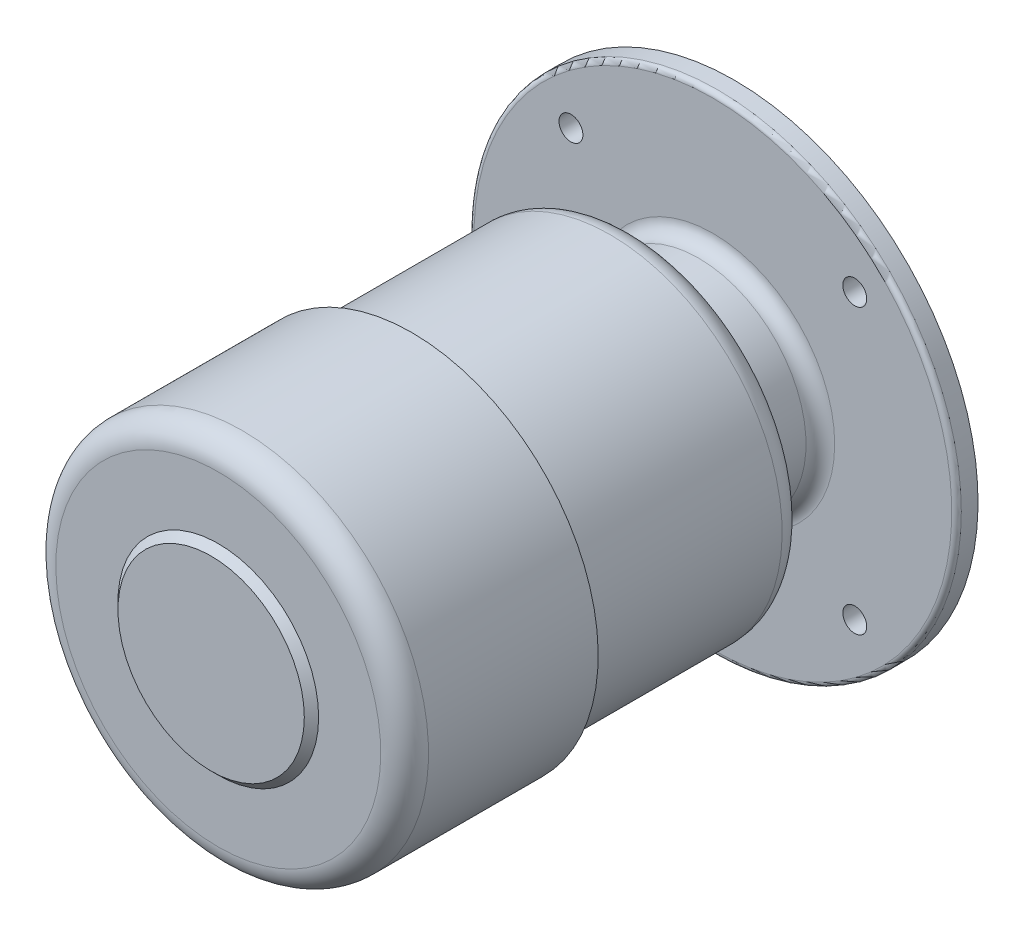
SolidWorks part; units mm, degrees
ref_plane "Plan de face" through (0, 0, 0) normal (0, 0, 1) x (1, 0, 0)
ref_plane "Plan de dessus" through (0, 0, 0) normal (0, 1, 0) x (1, 0, 0)
ref_plane "Plan de droite" through (0, 0, 0) normal (1, 0, 0) x (0, 0, -1)
ref_plane "Plan4" through (0, 0, 0) normal (0, -1, 0) x (1, 0, 0)
sketch "Esquisse1" plane through (0, 0, 0) normal (0, -1, 0) x (1, 0, 0)
  line L0 (78, 226) -> (0, 226)
  line L1 (0, 226) -> (0, 10)
  line L2 (0, 10) -> (102, 10)
  line L3 (102, 10) -> (102, 19)
  line L4 (102, 19) -> (45, 19)
  line L5 (45, 19) -> (45, 52)
  line L6 (45, 52) -> (72, 52)
  line L7 (72, 52) -> (72, 145)
  line L8 (72, 145) -> (78, 145)
  line L9 (78, 145) -> (78, 226)
  line L10 (0, 226) -> (0, 10) construction
revolve "Révolution1" add sketch "Esquisse1" angle 360 about L10
sketch "Esquisse2" plane through (0, 0, 10) normal (0, 0, -1) x (-1, 0, 0)
  circle A0 centre (0, 0) radius 66
extrude "Extrusion1" add sketch "Esquisse2" along normal blind 6
sketch "Esquisse3" plane through (0, 0, 4) normal (0, 0, -1) x (-1, 0, 0)
  line L0 (6.364, 2.1213) -> (10.3372, 6.0945)
  line L1 (6.0945, 10.3372) -> (2.1213, 6.364)
  line L2 (2.1213, 6.364) -> (6.364, 2.1213)
  arc A0 (10.3372, 6.0945) -> (6.0945, 10.3372) centre (0, 0) cw
extrude "Extrusion2" add sketch "Esquisse3" along normal blind 36
sketch "Esquisse4" plane through (0, 0, 226) normal (0, 0, 1) x (1, 0, 0)
  circle A0 centre (0, 0) radius 42
extrude "Extrusion3" add sketch "Esquisse4" along normal blind 3 draft 45
hole_wizard "Diamètre du perçage M10.0 (10)1" positions "Esquisse6" profile "Esquisse5" hole size "M10.0" standard "Ansi Métrique"
sketch "Esquisse6" plane through (0, 0, 19) normal (0, 0, 1) x (1, 0, 0)
  point P0 (59.397, -59.397)
sketch "Esquisse5" plane through (59.397, -59.397, 19) normal (1, 0, 0) x (0, -1, 0)
  line L0 (0, 0) -> (0, 9)
  line L1 (0, 9) -> (5, 9)
  line L2 (5, 9) -> (5, 0)
  line L5 (5, 0) -> (0, 0)
  line L11 (0, -6.35) -> (0, 107.95) construction
  dimension "Diamètre du perçage jusqu'au prochain" = 10
  dimension "Profondeur du perçage jusqu'au prochain" = 9
hole_wizard "Diamètre du perçage M10.0 (10)2" positions "Esquisse8" profile "Esquisse7" hole size "M10.0" standard "Ansi Métrique"
sketch "Esquisse8" plane through (0, 0, 19) normal (0, 0, 1) x (1, 0, 0)
  point P0 (59.397, 59.397)
sketch "Esquisse7" plane through (59.397, 59.397, 19) normal (1, 0, 0) x (0, -1, 0)
  line L0 (0, 0) -> (0, 9)
  line L1 (0, 9) -> (5, 9)
  line L2 (5, 9) -> (5, 0)
  line L5 (5, 0) -> (0, 0)
  line L11 (0, -6.35) -> (0, 107.95) construction
  dimension "Diamètre du perçage jusqu'au prochain" = 10
  dimension "Profondeur du perçage jusqu'au prochain" = 9
hole_wizard "Diamètre du perçage M10.0 (10)3" positions "Esquisse10" profile "Esquisse9" hole size "M10.0" standard "Ansi Métrique"
sketch "Esquisse10" plane through (0, 0, 19) normal (0, 0, 1) x (1, 0, 0)
  point P0 (-59.397, -59.397)
sketch "Esquisse9" plane through (-59.397, -59.397, 19) normal (1, 0, 0) x (0, -1, 0)
  line L0 (0, 0) -> (0, 9)
  line L1 (0, 9) -> (5, 9)
  line L2 (5, 9) -> (5, 0)
  line L5 (5, 0) -> (0, 0)
  line L11 (0, -6.35) -> (0, 107.95) construction
  dimension "Diamètre du perçage jusqu'au prochain" = 10
  dimension "Profondeur du perçage jusqu'au prochain" = 9
hole_wizard "Diamètre du perçage M10.0 (10)4" positions "Esquisse12" profile "Esquisse11" hole size "M10.0" standard "Ansi Métrique"
sketch "Esquisse12" plane through (0, 0, 19) normal (0, 0, 1) x (1, 0, 0)
  point P0 (-59.397, 59.397)
sketch "Esquisse11" plane through (-59.397, 59.397, 19) normal (1, 0, 0) x (0, -1, 0)
  line L0 (0, 0) -> (0, 9)
  line L1 (0, 9) -> (5, 9)
  line L2 (5, 9) -> (5, 0)
  line L5 (5, 0) -> (0, 0)
  line L11 (0, -6.35) -> (0, 107.95) construction
  dimension "Diamètre du perçage jusqu'au prochain" = 10
  dimension "Profondeur du perçage jusqu'au prochain" = 9
chamfer "Chanfrein1" distance 2 angle 45 1 edges at (8.4853, -8.4853, -32)
fillet "Congé1" radius 2 1 edges at (0, 102, 19)
fillet "Congé2" radius 6 1 edges at (0, 45, 52)
fillet "Congé3" radius 6 1 edges at (0, 45, 19)
fillet "Congé4" radius 10 1 edges at (0, 72, 52)
fillet "Congé5" radius 10 1 edges at (0, 78, 226)
